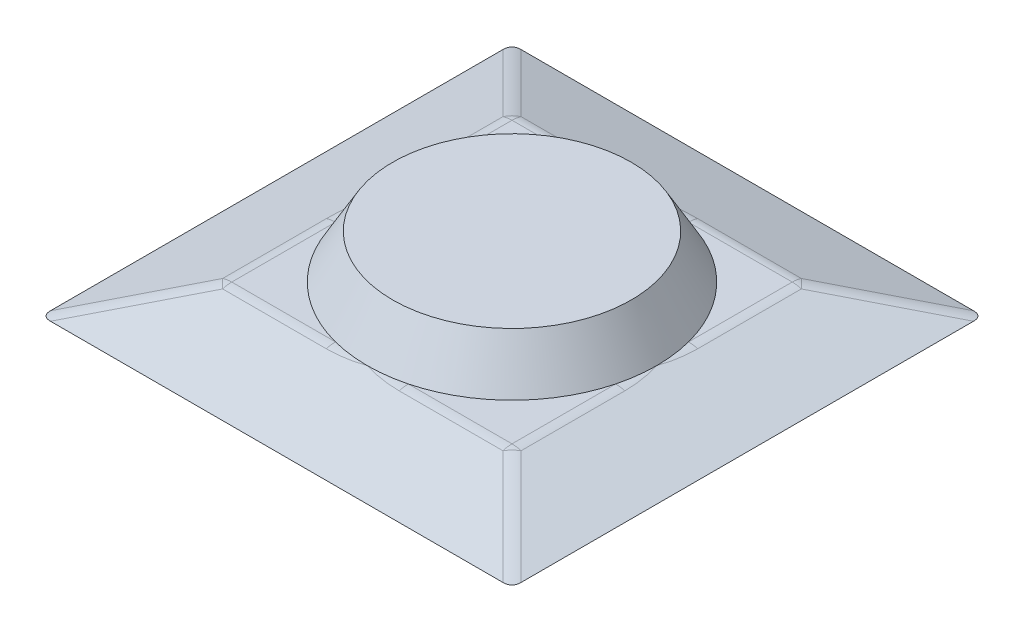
SolidWorks part; units mm, degrees
ref_plane "Front Plane" through (0, 0, 0) normal (0, 0, 1) x (1, 0, 0)
ref_plane "Top Plane" through (0, 0, 0) normal (0, 1, 0) x (1, 0, 0)
ref_plane "Right Plane" through (0, 0, 0) normal (1, 0, 0) x (0, 0, -1)
sketch "Sketch1" plane through (0, 0, 0) normal (0, 1, 0) x (1, 0, 0)
  line L1 (160, -160) -> (-160, -160)
  line L2 (160, -160) -> (160, 160)
  line L3 (160, 160) -> (-160, 160)
  line L4 (-160, -160) -> (-160, 160)
  line L5 (160, -160) -> (-160, 160) construction
  line L6 (160, 160) -> (-160, -160) construction
  point P0 (0, 0)
  dimension "D1" = 320
  dimension "D2" = 320
extrude "Boss-Extrude1" add sketch "Sketch1" along normal blind 20 draft 72
sketch "Sketch5" plane through (0, 20, 0) normal (0, 1, 0) x (1, 0, 0)
  circle A0 centre (0, 0) radius 98.4463
extrude "Boss-Extrude3" add sketch "Sketch5" along normal blind 30 draft 30
fillet "Fillet5" radius 20 12 edges at (129.2232, 10, -129.2232) (-129.2232, 10, -129.2232) (-129.2232, 10, 129.2232) (129.2232, 10, 129.2232) (98.4463, 20, 49.2232) (98.4463, 20, -49.2232) (49.2232, 20, -98.4463) (-49.2232, 20, -98.4463) (-98.4463, 20, -49.2232) (-98.4463, 20, 49.2232) (-49.2232, 20, 98.4463) (49.2232, 20, 98.4463)
